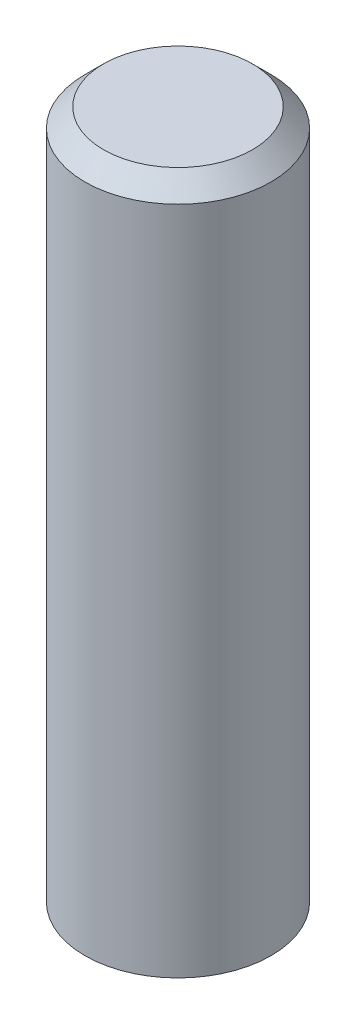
SolidWorks part; units mm, degrees
ref_plane "Plan de face" through (0, 0, 0) normal (0, 0, 1) x (1, 0, 0)
ref_plane "Plan de dessus" through (0, 0, 0) normal (0, 1, 0) x (1, 0, 0)
ref_plane "Plan de droite" through (0, 0, 0) normal (1, 0, 0) x (0, 0, -1)
ref_plane "Plan1" through (0, 0, 0) normal (0, 0, -1) x (-1, 0, 0)
sketch "Esquisse1" plane through (0, 0, 0) normal (0, 0, -1) x (-1, 0, 0)
  line L0 (-5, 0) -> (0, 0)
  line L1 (0, 0) -> (0, 37)
  line L2 (0, 37) -> (-4, 37)
  line L3 (-4, 37) -> (-5, 36)
  line L4 (-5, 36) -> (-5, 0)
  line L5 (0, 0) -> (0, 37) construction
  dimension "D1" = 5
  dimension "D2" = 37
  dimension "D3" = 36
  dimension "D4" = 4
revolve "Révolution1" add sketch "Esquisse1" angle 360 about L5
